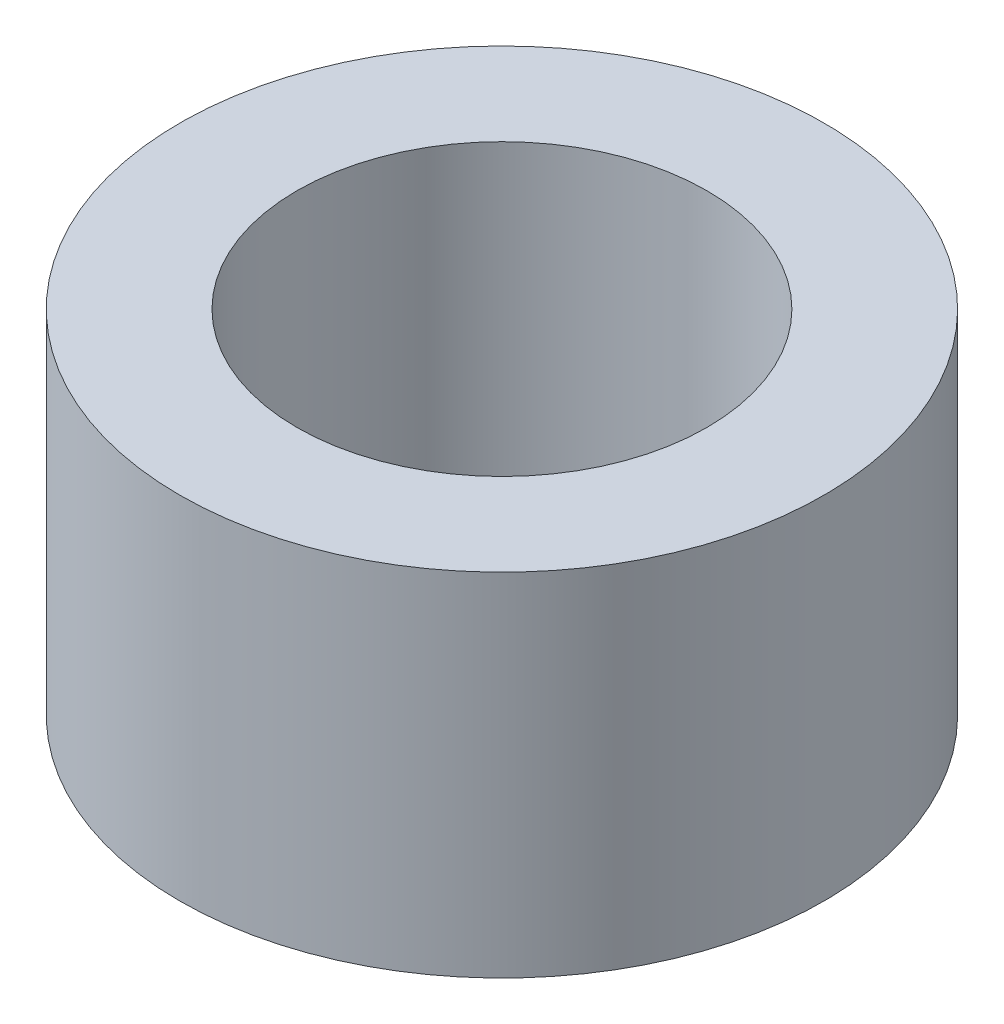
SolidWorks part; units mm, degrees
ref_plane "Спереди" through (0, 0, 0) normal (0, 0, 1) x (1, 0, 0)
ref_plane "Сверху" through (0, 0, 0) normal (0, 1, 0) x (1, 0, 0)
ref_plane "Справа" through (0, 0, 0) normal (1, 0, 0) x (0, 0, -1)
sketch "Эскиз1" plane through (0, 0, 0) normal (0, 1, 0) x (1, 0, 0)
  circle A0 centre (0, 0) radius 2.75
  circle A1 centre (0, 0) radius 1.75
  dimension "D1" = 3.5
  dimension "D2" = 5.5
extrude "Бобышка-Вытянуть1" add sketch "Эскиз1" along normal blind 3
